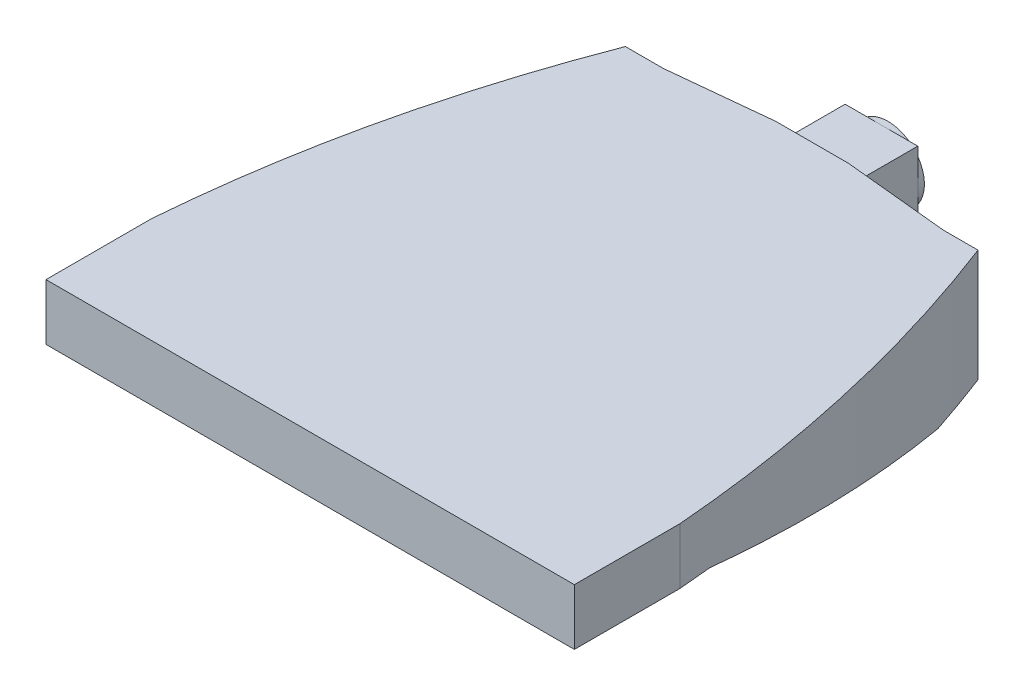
SolidWorks part; units mm, degrees
ref_plane "Front Plane" through (0, 0, 0) normal (0, 0, 1) x (1, 0, 0)
ref_plane "Top Plane" through (0, 0, 0) normal (0, 1, 0) x (1, 0, 0)
ref_plane "Right Plane" through (0, 0, 0) normal (1, 0, 0) x (0, 0, -1)
sketch "Schizzo1" plane through (0, 0, 0) normal (0, 1, 0) x (1, 0, 0)
  line L0 (-25.5, -23.9407) -> (54.5, -23.9407)
  line L1 (14.5, -23.9407) -> (14.5, 62.5593)
  line L2 (14.5, 91.0608) -> (14.5, -50.8296) construction
  line L3 (9, 62.5593) -> (20, 62.5593)
  line L4 (9, 62.5593) -> (9, 52.0593)
  line L5 (9, 52.0593) -> (20, 52.0593)
  line L6 (20, 62.5593) -> (20, 52.0593)
  line L7 (-25.5, -23.9407) -> (-25.5, -7.9407)
  line L8 (54.5, -23.9407) -> (54.5, -7.9407)
  line L9 (-12.1947, 50.4823) -> (41.1947, 50.4823)
  line L10 (-6.4266, 50.4823) -> (9, 52.0593)
  line L11 (20, 52.0593) -> (35.9272, 50.4823)
  spline S0 degree 2 poles (-25.5, -7.9407) (-23.065, 22.2268) (-12.1947, 50.4823) knots 0 0 0 1 1 1
  spline S1 degree 2 poles (54.5, -7.9407) (52.065, 22.2268) (41.1947, 50.4823) knots 0 0 0 1 1 1
  dimension "D1" = 80
  dimension "D3" = 86.5
  dimension "D4" = 10.5
  dimension "D5" = 0
  dimension "D6" = 11
  dimension "D7" = 5.5
  dimension "D8" = 16
extrude "Estrusione-Estrusione1" add sketch "Schizzo1" along normal blind 17 contours S0 L7 L0 L1 L9 | L8 S1 L9 L1 L0 | L4 L5 L1 L3 | L6 L3 L1 L5 | L11 L5 L1 L9 | L10 L9 L1 L5
sketch "Schizzo2" plane through (20, 0, 0) normal (1, 0, 0) x (0, 0, -1)
  line L0 (62.5593, 17) -> (62.5593, 0) construction
  line L1 (62.5593, 14) -> (52.0593, 14)
  line L2 (62.5593, 14) -> (62.5593, 3)
  line L3 (62.5593, 3) -> (52.0593, 3)
  line L4 (52.0593, 14) -> (52.0593, 3)
  line L5 (52.0593, 17) -> (52.0593, 0) construction
  line L6 (62.5593, 0) -> (52.0593, 0) construction
  dimension "D1" = 11
  dimension "D2" = 3
extrude "Taglio-Estrusione1" cut sketch "Schizzo2" against normal blind 11 contours L1 M2 M3 M4 | L3 M2 M4 M1
sketch "Schizzo3" plane through (54.5, 0, 0) normal (1, 0, 0) x (0, 0, -1)
  line L0 (-23.9407, 8.5) -> (-7.9407, 8.5)
  line L1 (-23.9407, 17) -> (-23.9407, 0) construction
  line L2 (-7.9407, 17) -> (-7.9407, 0) construction
  line L3 (-7.9407, 8.5) -> (-2.9415, 8.5)
  line L4 (-2.9415, 8.5) -> (41.0271, 17)
  line L5 (50.4823, 17) -> (-7.9407, 17) construction
  line L6 (41.0271, 17) -> (50.4823, 17)
  line L7 (41.0271, 17) -> (-23.9407, 17)
  line L8 (-23.9407, 17) -> (-23.9407, 8.5)
extrude "Taglio-Estrusione2" cut sketch "Schizzo3" against normal blind 80 contours L4 L7 L3 M2 | L0 M4 M2 M3
sketch "Schizzo4" plane through (0, 0, -62.5593) normal (0, 0, -1) x (-1, 0, 0)
  line L0 (-20, 14) -> (-20, 3) construction
  line L1 (-9, 3) -> (-20, 3) construction
  circle A0 centre (-14.5, 8.5) radius 5.5
  dimension "D1" = 11
  dimension "D2" = 5.5
  dimension "D3" = 5.5
extrude "Estrusione-Estrusione2" add sketch "Schizzo4" along normal blind 1
mirror "Specchia1" about plane through (0, 0, 0) normal (0, 1, 0)
sketch "Schizzo5" plane through (0, 17, 0) normal (0, 1, 0) x (1, 0, 0)
  line L1 (-28.5686, -40.9097) -> (60.1924, -40.9097)
  line L2 (-28.5686, -40.9097) -> (-28.5686, 79.4864)
  line L3 (-28.5686, 79.4864) -> (60.1924, 79.4864)
  line L4 (60.1924, -40.9097) -> (60.1924, 79.4864)
extrude "Taglio-Estrusione3" cut sketch "Schizzo5" against normal blind 17
